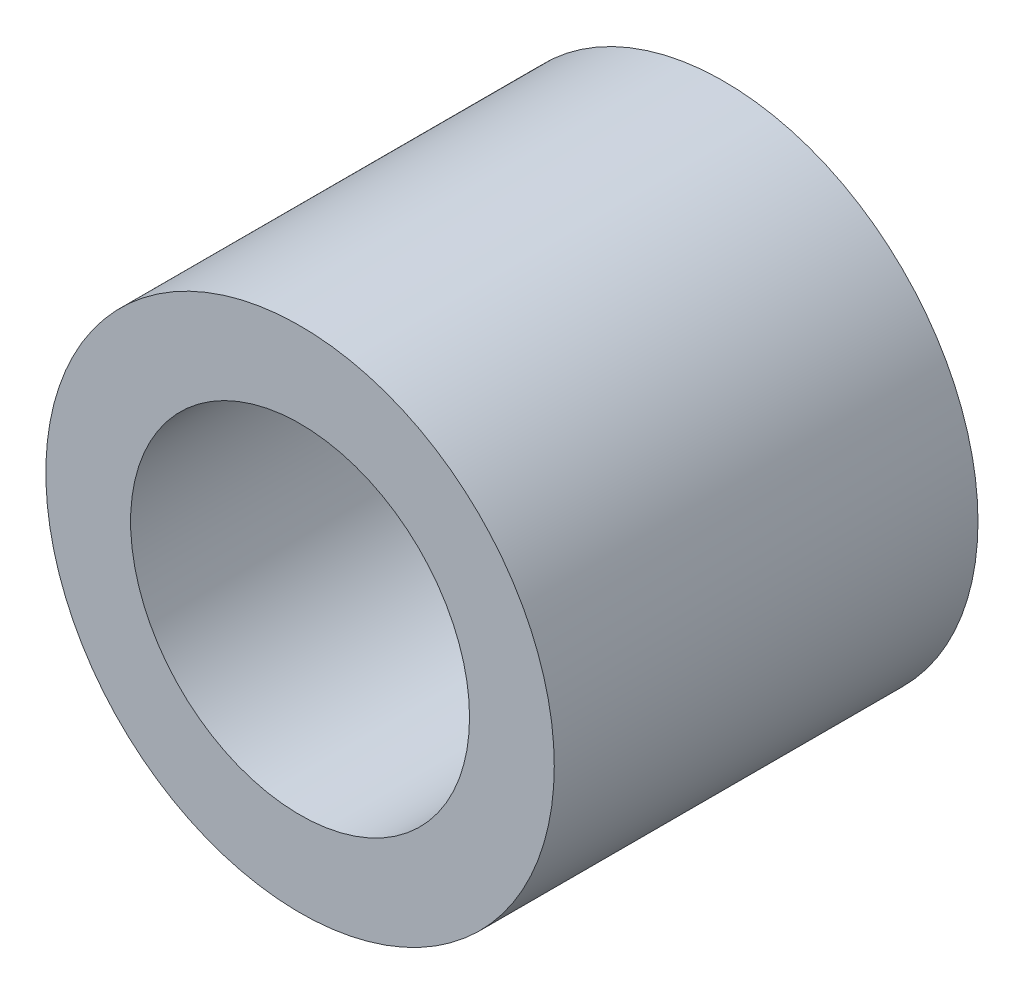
SolidWorks part; units mm, degrees
ref_plane "Plan de face" through (0, 0, 0) normal (0, 0, 1) x (1, 0, 0)
ref_plane "Plan de dessus" through (0, 0, 0) normal (0, 1, 0) x (1, 0, 0)
ref_plane "Plan de droite" through (0, 0, 0) normal (1, 0, 0) x (0, 0, -1)
sketch "Esquisse1" plane through (0, 0, 0) normal (0, 0, 1) x (1, 0, 0)
  circle A0 centre (0, 0) radius 45
  circle A1 centre (0, 0) radius 30
  dimension "D1" = 90
  dimension "D2" = 60
extrude "Boss.-Extru.1" add sketch "Esquisse1" along normal blind 75
